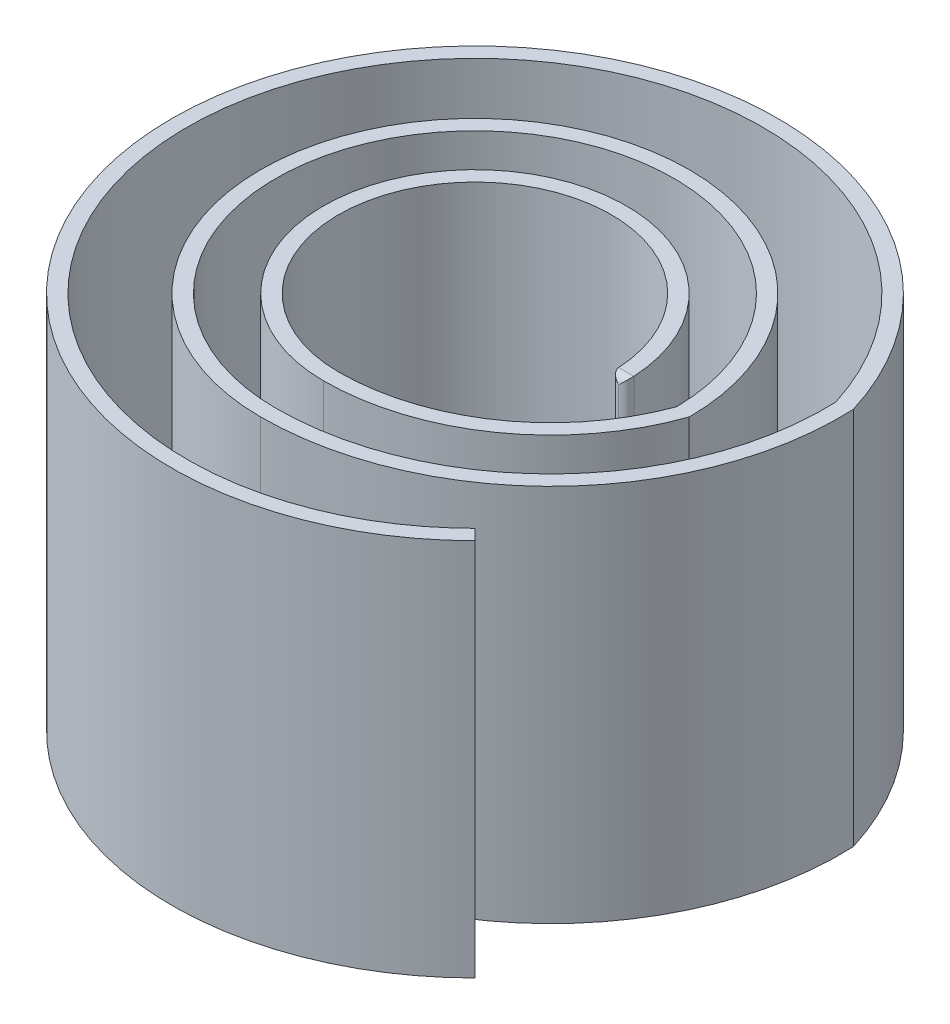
SolidWorks part; units mm, degrees
ref_plane "前视基准面" through (0, 0, 0) normal (0, 0, 1) x (1, 0, 0)
ref_plane "上视基准面" through (0, 0, 0) normal (0, 1, 0) x (1, 0, 0)
ref_plane "右视基准面" through (0, 0, 0) normal (1, 0, 0) x (0, 0, -1)
other "Configuration Table"
sketch "草图1" plane through (0, 0, 0) normal (0, 1, 0) x (1, 0, 0)
  line L0 (0, 0) -> (57.2732, 0) construction
  line L1 (0, 0) -> (0, 14.9566) construction
  line L2 (28.2843, 0) -> (28.2843, -17.9461) construction
  line L3 (0, 0) -> (42.2586, -42.2586) construction
  line L4 (28.2843, -28.2843) -> (26.8701, -26.8701)
  line L5 (25.4191, -28.2466) -> (25.4191, -28.2466)
  line L6 (20, 0) -> (18, 0)
  line L7 (25.4191, -28.2466) -> (26.8701, -26.8701)
  arc A0 (38.2458, 11.7157) -> (28.2843, -28.2843) centre (0, 0) ccw
  arc A1 (20, 0) -> (0, -20) centre (0, 0) ccw
  arc A2 (0, -20) -> (28.2843, 0) centre (0, 10) ccw
  arc A3 (28.2843, 0) -> (0, -28.2843) centre (0, 0) ccw
  arc A4 (0, -28.2843) -> (38.2458, 11.7157) centre (0, 10) ccw
  arc A5 (18, 0) -> (0, -18) centre (0, 0) ccw
  arc A6 (0, -18) -> (26.282, 0.3431) centre (0, 10) ccw
  arc A7 (26.282, 0.3431) -> (0, -26.2843) centre (0, 0) ccw
  arc A8 (0, -26.2843) -> (36.2583, 11.3726) centre (0, 10) ccw
  arc A9 (36.2583, 11.3726) -> (25.4191, -28.2466) centre (0, 0) ccw
  dimension "D1" = 80
  dimension "D2" = 40
  dimension "D4" = 45
  dimension "D3" = 10
  dimension "D5" = 2
  dimension "D6" = 2
extrude "凸台-拉伸1" add sketch "草图1" along normal blind 50 contours A9 A8 A7 A6 A5 L6 A1 A2 A3 A4 A0 L4 L7
fillet "圆角3" radius 1 4 edges at (18, 25, 0) (19, 50, 0) (20, 25, 0) (19, 0, 0)
